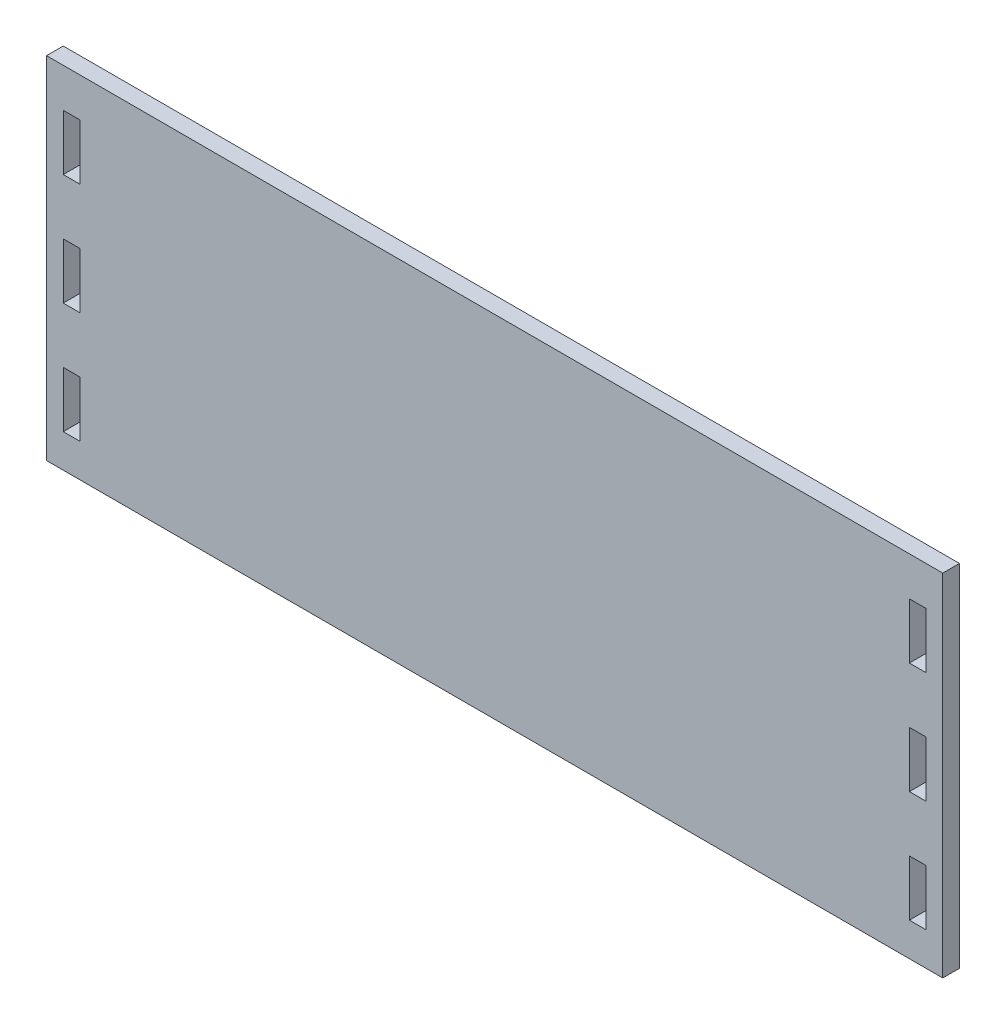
SolidWorks part; units mm, degrees
ref_plane "Front Plane" through (0, 0, 0) normal (0, 0, 1) x (1, 0, 0)
ref_plane "Top Plane" through (0, 0, 0) normal (0, 1, 0) x (1, 0, 0)
ref_plane "Right Plane" through (0, 0, 0) normal (1, 0, 0) x (0, 0, -1)
sketch "Sketch1" plane through (0, 0, 0) normal (0, 0, 1) x (1, 0, 0)
  line L0 (80.5, 0) -> (77.5, 0) construction
  line L1 (-80.5, 31.5) -> (80.5, 31.5)
  line L2 (-80.5, 31.5) -> (-80.5, -31.5)
  line L3 (-80.5, -31.5) -> (80.5, -31.5)
  line L4 (80.5, 31.5) -> (80.5, -31.5)
  line L5 (-80.5, 31.5) -> (80.5, -31.5) construction
  line L6 (-80.5, -31.5) -> (80.5, 31.5) construction
  line L7 (77.5, 31.5) -> (77.5, -31.5) construction
  line L8 (77.5, -31.5) -> (77.5, -25.5) construction
  line L9 (77.5, -5.5) -> (77.5, 4.5)
  line L10 (77.5, -25.5) -> (74.5, -25.5)
  line L11 (77.5, -25.5) -> (77.5, -15.5)
  line L12 (77.5, -15.5) -> (74.5, -15.5)
  line L13 (74.5, -25.5) -> (74.5, -15.5)
  line L14 (77.5, -25.5) -> (74.5, -15.5) construction
  line L15 (77.5, -15.5) -> (74.5, -25.5) construction
  line L16 (77.5, 4.5) -> (74.5, 4.5)
  line L17 (74.5, -5.5) -> (74.5, 4.5)
  line L18 (77.5, -5.5) -> (74.5, -5.5)
  line L19 (77.5, 14.5) -> (77.5, 24.5)
  line L20 (77.5, 24.5) -> (74.5, 24.5)
  line L21 (74.5, 14.5) -> (74.5, 24.5)
  line L22 (77.5, 14.5) -> (74.5, 14.5)
  line L23 (-80.5, -31.5) -> (-77.5, -31.5) construction
  line L24 (-77.5, -31.5) -> (-77.5, 31.5) construction
  line L25 (-77.5, -31.5) -> (-77.5, -25.5) construction
  line L26 (-77.5, 4.5) -> (-74.5, 4.5)
  line L27 (-77.5, -25.5) -> (-74.5, -25.5)
  line L28 (-77.5, -25.5) -> (-77.5, -15.5)
  line L29 (-77.5, -15.5) -> (-74.5, -15.5)
  line L30 (-74.5, -25.5) -> (-74.5, -15.5)
  line L31 (-77.5, -25.5) -> (-74.5, -15.5) construction
  line L32 (-77.5, -15.5) -> (-74.5, -25.5) construction
  line L33 (-77.5, -5.5) -> (-77.5, 4.5)
  line L34 (-77.5, -5.5) -> (-74.5, -5.5)
  line L35 (-74.5, -5.5) -> (-74.5, 4.5)
  line L36 (-77.5, 24.5) -> (-74.5, 24.5)
  line L37 (-77.5, 14.5) -> (-77.5, 24.5)
  line L38 (-77.5, 14.5) -> (-74.5, 14.5)
  line L39 (-74.5, 14.5) -> (-74.5, 24.5)
  point P0 (0, 0)
  point P14 (76, -20.5)
  point P29 (-76, -20.5)
extrude "Boss-Extrude1" add sketch "Sketch1" along normal blind 3
equation "\"length\"= 155 + 6mm"
equation "\"width\"= 63mm"
equation "\"heigght\"= 3mm"
equation "\"D1@Sketch1\"=\"length\""
equation "\"D2@Sketch1\"=\"width\""
equation "\"fingre_l\"= 10mm"
equation "\"finger_w\"= 3mm"
equation "\"D5@Sketch1\"=\"finger_w\""
equation "\"D6@Sketch1\"=\"fingre_l\""
equation "\"D10@Sketch1\"=\"finger_w\""
equation "\"D11@Sketch1\"=\"fingre_l\""
equation "\"D1@Boss-Extrude1\"=\"heigght\""
